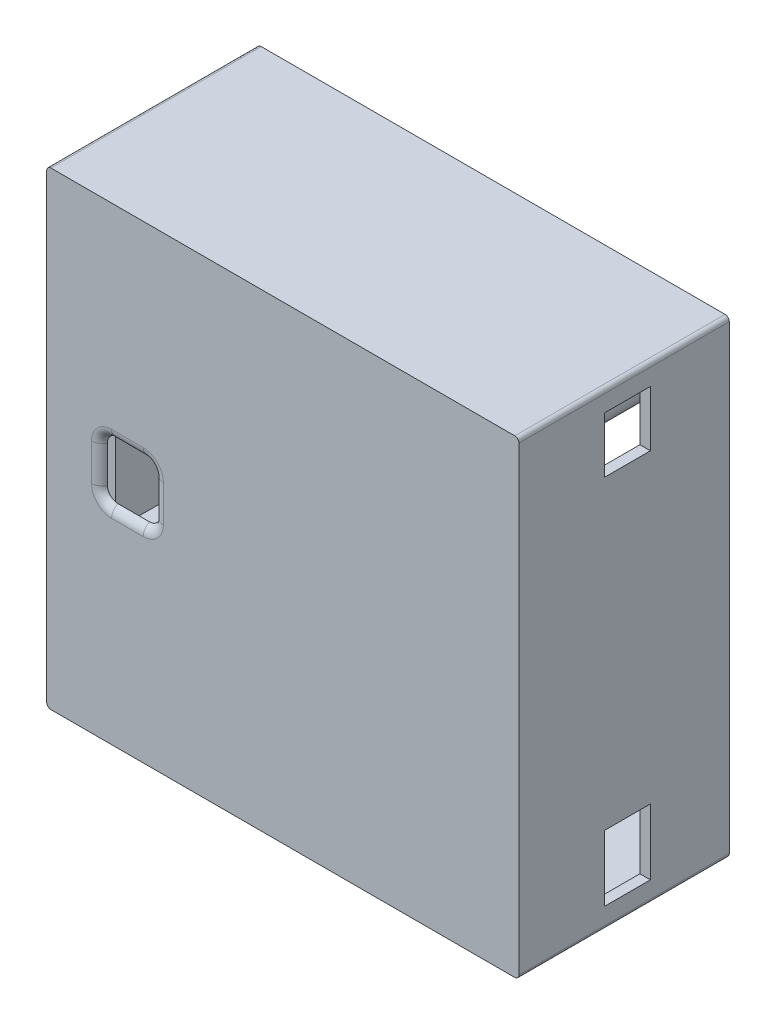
SolidWorks part; units mm, degrees
ref_plane "Front Plane" through (0, 0, 0) normal (0, 0, 1) x (1, 0, 0)
ref_plane "Top Plane" through (0, 0, 0) normal (0, 1, 0) x (1, 0, 0)
ref_plane "Right Plane" through (0, 0, 0) normal (1, 0, 0) x (0, 0, -1)
sketch "Sketch1" plane through (0, 0, 0) normal (0, 0, 1) x (1, 0, 0)
  line L0 (-44.9, -44.6) -> (-44.9, 44.6)
  line L1 (-39.9, -39.6) -> (39.9, -39.6)
  line L2 (-39.9, -39.6) -> (-39.9, 39.6)
  line L3 (-39.9, 39.6) -> (39.9, 39.6)
  line L4 (39.9, -39.6) -> (39.9, 39.6)
  line L5 (-39.9, -39.6) -> (39.9, 39.6) construction
  line L6 (-39.9, 39.6) -> (39.9, -39.6) construction
  line L7 (-44.9, 44.6) -> (44.9, 44.6)
  line L8 (44.9, -44.6) -> (44.9, 44.6)
  line L9 (-44.9, -44.6) -> (44.9, -44.6)
  point P0 (0, 0)
  dimension "D1" = 79.2
  dimension "D2" = 79.8
  dimension "D3" = 5
extrude "Boss-Extrude1" add sketch "Sketch1" along normal blind 40
sketch "Sketch2" plane through (0, 0, 40) normal (0, 0, 1) x (1, 0, 0)
  line L0 (39.9, -39.6) -> (39.9, 39.6) construction
  line L1 (39.9, 39.6) -> (-39.9, 39.6) construction
  line L2 (31.8973, 39.6) -> (39.9, 39.6)
  line L3 (39.9, 39.6) -> (39.9, 30.4655)
  line L4 (39.9, 0) -> (35.9467, 0)
  line L5 (39.9, -39.6) -> (39.9, -30.4655)
  line L6 (31.8973, -39.6) -> (39.9, -39.6)
  line L7 (0, 39.6) -> (0, 51.3482) construction
  line L8 (-31.8973, -39.6) -> (-39.9, -39.6)
  line L9 (-39.9, -39.6) -> (-39.9, -30.4655)
  line L10 (-39.9, 0) -> (-35.9467, 0)
  line L11 (-39.9, 39.6) -> (-39.9, 30.4655)
  line L12 (-31.8973, 39.6) -> (-39.9, 39.6)
  arc A0 (39.9, 30.4655) -> (31.8973, 39.6) centre (37.6432, 36.5611) cw
  arc A1 (39.9, -30.4655) -> (31.8973, -39.6) centre (37.6432, -36.5611) ccw
  arc A2 (-39.9, -30.4655) -> (-31.8973, -39.6) centre (-37.6432, -36.5611) cw
  arc A3 (-39.9, 30.4655) -> (-31.8973, 39.6) centre (-37.6432, 36.5611) ccw
  dimension "D1" = 6.5
extrude "Boss-Extrude2" add sketch "Sketch2" against normal blind 30.82 contours A3 M10 M7 | A0 M8 M7 | A2 M10 M9
sketch "Sketch3" plane through (0, 0, 40) normal (0, 0, 1) x (1, 0, 0)
  line L0 (-31.8973, -39.6) -> (39.9, -39.6) construction
  line L1 (30.704, -39.6) -> (20.704, -39.6)
  line L2 (30.704, -39.6) -> (30.704, -30.067)
  line L3 (30.704, -30.067) -> (20.704, -30.067)
  line L4 (20.704, -39.6) -> (20.704, -30.067)
  point P6 (30.704, -39.6)
  dimension "D1" = 10
extrude "Boss-Extrude3" add sketch "Sketch3" against normal blind 30.82 separate body
sketch "Sketch4" plane through (0, 0, 40) normal (0, 0, 1) x (1, 0, 0)
  line L0 (31.8973, 39.6) -> (-31.8973, 39.6) construction
  line L1 (39.9, -39.6) -> (-39.9, -39.6)
  line L2 (39.9, -39.6) -> (39.9, 39.6)
  line L3 (39.9, 39.6) -> (-39.9, 39.6)
  line L4 (-39.9, -39.6) -> (-39.9, 39.6)
  line L5 (-39.9, 30.4655) -> (-39.9, -30.4655) construction
  dimension "D1" = 0
  dimension "D2" = 0
extrude "Cut-Extrude1" cut sketch "Sketch4" against normal blind 25
sketch "Sketch6" plane through (0, 0, 9.18) normal (0, 0, -1) x (-1, 0, 0)
  line L0 (0, 39.6) -> (0, 35.6)
  line L1 (-39.9, 39.6) -> (39.9, 39.6) construction
  circle A0 centre (-36, 35.6) radius 7
  circle A1 centre (-36, 35.6) radius 2.25
  circle A3 centre (35.8, 35.4) radius 2.25
  circle A4 centre (35.5, -35.3) radius 2.25
  circle A5 centre (-26.2, -34.8) radius 2.25
  dimension "D1" = 14
  dimension "D2" = 4.5
  dimension "D3" = 4.5
  dimension "D4" = 4.5
  dimension "D5" = 4.5
extrude "Boss-Extrude4" add sketch "Sketch6" along normal blind 2.5 contours A1 | A3 | A4 | A5
sketch "Sketch7" plane through (0, 0, 15) normal (0, 0, 1) x (1, 0, 0)
  line L0 (-39.9, 0) -> (-37.6432, 0)
  line L1 (-39.9, 39.6) -> (-39.9, -39.6) construction
  arc A0 (-31.8973, -39.6) -> (-39.9, -30.4655) centre (-37.6432, -36.5611) ccw
  arc A1 (-31.8973, -39.6) -> (-39.9, -30.4655) centre (-39.5186, -38.2041) ccw
  arc A2 (-31.8973, 39.6) -> (-39.9, 30.4655) centre (-39.5186, 38.2041) cw
  arc A3 (-31.8973, 39.6) -> (-39.9, 30.4655) centre (-37.6432, 36.5611) cw
extrude "Cut-Extrude2" cut sketch "Sketch7" against normal blind 18 contours A3 A2 | A1 M2
sketch "Sketch8" plane through (0, 0, 6.68) normal (0, 0, -1) x (-1, 0, 0)
  circle A0 centre (-26.2, -34.8) radius 2.25
  circle A1 centre (-26.2, -34.8) radius 2.4
  circle A2 centre (-36, 35.6) radius 2.4
  circle A3 centre (35.8, 35.4) radius 2.4
  circle A4 centre (35.5, -35.3) radius 2.4
  dimension "D1" = 4.8
  dimension "D2" = 4.8
  dimension "D3" = 4.8
  dimension "D4" = 4.8
extrude "Boss-Extrude5" add sketch "Sketch8" against normal up to surface (8.32 mm away)
sketch "Sketch9" plane through (0, 0, 0) normal (0, 0, -1) x (-1, 0, 0)
  line L0 (-41.1, -40.8) -> (41.1, -40.8)
  line L1 (-39.9, -39.6) -> (39.9, -39.6)
  line L2 (-39.9, -39.6) -> (-39.9, 39.6)
  line L3 (-39.9, 39.6) -> (39.9, 39.6)
  line L4 (39.9, -39.6) -> (39.9, 39.6)
  line L5 (41.1, -40.8) -> (41.1, 40.8)
  line L6 (-41.1, 40.8) -> (41.1, 40.8)
  line L7 (-41.1, -40.8) -> (-41.1, 40.8)
  dimension "D1" = 1.2
extrude "Cut-Extrude3" cut sketch "Sketch9" against normal up to surface (9.18 mm away)
sketch "Sketch10" plane through (0, 0, 40) normal (0, 0, 1) x (1, 0, 0)
  line L0 (42.9, 42.6) -> (-42.9, 42.6)
  line L1 (39.9, 39.6) -> (-39.9, 39.6)
  line L2 (39.9, 39.6) -> (39.9, -39.6)
  line L3 (39.9, -39.6) -> (-39.9, -39.6)
  line L4 (-39.9, 39.6) -> (-39.9, -39.6)
  line L5 (-42.9, 42.6) -> (-42.9, -42.6)
  line L6 (42.9, -42.6) -> (-42.9, -42.6)
  line L7 (42.9, 42.6) -> (42.9, -42.6)
  dimension "D1" = 3
extrude "Cut-Extrude4" cut sketch "Sketch10" against normal up to surface (25 mm away)
sketch "Sketch11" plane through (42.9, 0, 0) normal (-1, 0, 0) x (0, 0, 1)
  line L0 (15, 42.6) -> (15, -42.6) construction
  line L1 (15, 40.63) -> (23.7, 40.63)
  line L2 (15, 40.63) -> (15, 30.03)
  line L3 (15, 30.03) -> (23.7, 30.03)
  line L4 (23.7, 40.63) -> (23.7, 30.03)
  line L5 (15, 42.6) -> (40, 42.6) construction
  line L6 (15, -42.6) -> (40, -42.6) construction
  line L7 (15, -40.63) -> (23.7, -40.63)
  line L8 (15, -40.63) -> (15, -28.13)
  line L9 (15, -28.13) -> (23.7, -28.13)
  line L10 (23.7, -40.63) -> (23.7, -28.13)
extrude "Cut-Extrude5" cut sketch "Sketch11" against normal blind 6
sketch "Sketch12" plane through (42.9, 0, 0) normal (-1, 0, 0) x (0, 0, 1)
  line L39 (15, 42.63) -> (15, 40.63)
  line L40 (15, 40.63) -> (23.7, 40.63)
  line L41 (23.7, 40.63) -> (23.7, 30.03)
  line L42 (15, 28.03) -> (25.7, 28.03)
  line L43 (25.7, 42.63) -> (15, 42.63)
  line L44 (25.7, 28.03) -> (25.7, 42.63)
  line L45 (15, 28.03) -> (25.7, 28.03)
  line L46 (25.7, 42.63) -> (15, 42.63)
  line L47 (25.7, 28.03) -> (25.7, 42.63)
  line L48 (23.7, 30.03) -> (15, 30.03)
  line L49 (15, 30.03) -> (15, 28.03)
  line L56 (15, -26.13) -> (15, -28.13)
  line L57 (15, -28.13) -> (23.7, -28.13)
  line L58 (23.7, -28.13) -> (23.7, -40.63)
  line L59 (15, -42.63) -> (25.7, -42.63)
  line L60 (25.7, -26.13) -> (15, -26.13)
  line L61 (25.7, -42.63) -> (25.7, -26.13)
  line L62 (15, -42.63) -> (25.7, -42.63)
  line L63 (25.7, -26.13) -> (15, -26.13)
  line L64 (25.7, -42.63) -> (25.7, -26.13)
  line L65 (23.7, -40.63) -> (15, -40.63)
  line L66 (15, -40.63) -> (15, -42.63)
  dimension "D1" = 2
  dimension "D2" = 2
extrude "Boss-Extrude6" add sketch "Sketch12" along normal blind 5
sketch "Sketch13" plane through (0, 0, 40) normal (0, 0, 1) x (1, 0, 0)
  line L17 (-44.9, -44.6) -> (44.9, -44.6)
  line L18 (44.9, -44.6) -> (44.9, 44.6)
  line L19 (44.9, 44.6) -> (-44.9, 44.6)
  line L20 (-44.9, 44.6) -> (-44.9, -44.6)
  line L21 (-44.9, -44.6) -> (44.9, -44.6)
  line L22 (44.9, -44.6) -> (44.9, 44.6)
  line L23 (44.9, 44.6) -> (-44.9, 44.6)
  line L24 (-44.9, 44.6) -> (-44.9, -44.6)
  line L35 (-42.9, -42.6) -> (42.9, -42.6)
  line L36 (42.9, -42.6) -> (42.9, 42.6)
  line L37 (42.9, 42.6) -> (-42.9, 42.6)
  line L38 (-42.9, 42.6) -> (-42.9, -42.6)
  line L39 (-42.9, -42.6) -> (42.9, -42.6)
  line L40 (42.9, -42.6) -> (42.9, 42.6)
  line L41 (42.9, 42.6) -> (-42.9, 42.6)
  line L42 (-42.9, 42.6) -> (-42.9, -42.6)
  dimension "D1" = 0
  dimension "D2" = 0
sketch "Sketch14" plane through (0, 0, 40) normal (0, 0, 1) x (1, 0, 0)
  line L1 (-44.9, 44.6) -> (44.9, 44.6)
  line L2 (-44.9, 44.6) -> (-44.9, -44.6)
  line L3 (-44.9, -44.6) -> (44.9, -44.6)
  line L4 (44.9, 44.6) -> (44.9, -44.6)
  line L5 (-42.9, 42.6) -> (42.9, 42.6) construction
  line L6 (-42.9, 42.6) -> (-42.9, -42.6) construction
  line L7 (-42.9, -42.6) -> (42.9, -42.6) construction
  line L8 (42.9, 42.6) -> (42.9, -42.6) construction
extrude "Boss-Extrude7" add sketch "Sketch14" against normal blind 1.2
sketch "Sketch15" plane through (0, 0, 38.8) normal (0, 0, -1) x (-1, 0, 0)
  circle A0 centre (-36, 35.6) radius 2.4
  circle A1 centre (35.8, 35.4) radius 2.4
  circle A2 centre (35.5, -35.3) radius 2.4
  circle A3 centre (-26.2, -34.8) radius 2.4
sketch "Sketch16" plane through (0, 0, 0) normal (0, 0, -1) x (-1, 0, 0)
  line L5 (-42.9, 42.6) -> (42.9, 42.6)
  line L6 (-42.9, 42.6) -> (-42.9, -42.6)
  line L7 (-42.9, -42.6) -> (42.9, -42.6)
  line L8 (42.9, 42.6) -> (42.9, -42.6)
extrude "Cut-Extrude7" cut sketch "Sketch16" against normal up to next
sketch "Sketch17" plane through (0, 0, 38.8) normal (0, 0, -1) x (-1, 0, 0)
  circle A0 centre (-36, 35.6) radius 2.4
  circle A1 centre (35.8, 35.4) radius 2.4
  circle A2 centre (35.5, -35.3) radius 2.4
  circle A3 centre (-26.2, -34.8) radius 2.4
  circle A4 centre (-36, 35.6) radius 3.9
  circle A5 centre (35.8, 35.4) radius 3.9
  circle A6 centre (35.5, -35.3) radius 3.9
  circle A7 centre (-26.2, -34.8) radius 3.9
  dimension "D1" = 1.5
extrude "Boss-Extrude8" add sketch "Sketch17" along normal blind 29.62 contours A4 | A5 | A6 | A7
sketch "Sketch18" plane through (0, 0, 9.18) normal (0, 0, -1) x (-1, 0, 0)
  circle A0 centre (-36, 35.6) radius 2
  circle A1 centre (35.8, 35.4) radius 2
  circle A2 centre (35.5, -35.3) radius 2
  circle A3 centre (-26.2, -34.8) radius 2
  dimension "D1" = 4
  dimension "D2" = 4
  dimension "D3" = 4
  dimension "D4" = 4
extrude "Boss-Extrude9" add sketch "Sketch18" along normal blind 2.5
sketch "Sketch19" plane through (0, 0, 38.8) normal (0, 0, -1) x (-1, 0, 0)
  line L0 (35.0326, -12) -> (35.0326, 12)
  line L1 (26.0326, 12) -> (35.0326, 12)
  line L2 (26.0326, -12) -> (26.0326, 12)
  line L3 (26.0326, -12) -> (35.0326, -12)
  line L4 (28.0326, -10) -> (28.0326, -12)
  line L5 (28.0326, -10) -> (33.0326, -10)
  line L6 (28.0326, -10) -> (28.0326, 10)
  line L7 (28.0326, 10) -> (33.0326, 10)
  line L8 (33.0326, -10) -> (33.0326, 10)
  line L9 (28.0326, -10) -> (33.0326, 10) construction
  line L10 (28.0326, 10) -> (33.0326, -10) construction
  line L11 (28.0326, -12) -> (28.0326, 12)
  point P0 (30.5326, 0)
  dimension "D1" = 5
extrude "Boss-Extrude10" add sketch "Sketch19" along normal blind 20 contours L11 L7 L8 L5 L4 L3 L0 L1
sketch "Sketch20" plane through (0, 0, 18.8) normal (0, 0, -1) x (-1, 0, 0)
  line L1 (28.0326, 12) -> (35.0326, 12)
  line L2 (28.0326, 12) -> (28.0326, -12)
  line L3 (28.0326, -12) -> (35.0326, -12)
  line L4 (35.0326, 12) -> (35.0326, -12)
extrude "Boss-Extrude11" add sketch "Sketch20" along normal blind 2
sketch "Sketch21" plane through (0, 0, 40) normal (0, 0, 1) x (1, 0, 0)
  line L0 (-32.5533, -5.5) -> (-26.5533, -5.5)
  line L1 (-34.5533, -3.5) -> (-34.5533, 3.5)
  line L2 (-32.5533, 5.5) -> (-26.5533, 5.5)
  line L3 (-24.5533, -3.5) -> (-24.5533, 3.5)
  line L4 (-34.5533, -5.5) -> (-24.5533, 5.5) construction
  line L5 (-34.5533, 5.5) -> (-24.5533, -5.5) construction
  arc A0 (-34.5533, 3.5) -> (-32.5533, 5.5) centre (-32.5533, 3.5) cw
  arc A1 (-34.5533, -3.5) -> (-32.5533, -5.5) centre (-32.5533, -3.5) ccw
  arc A2 (-26.5533, -5.5) -> (-24.5533, -3.5) centre (-26.5533, -3.5) ccw
  arc A3 (-26.5533, 5.5) -> (-24.5533, 3.5) centre (-26.5533, 3.5) cw
  point P0 (-29.5533, 0)
  dimension "D3" = 2
  dimension "D1" = 10
  dimension "D2" = 11
extrude "Cut-Extrude9" cut sketch "Sketch21" against normal blind 1.2
fillet "Fillet1" radius 2 8 edges at (-33.9675, 4.9142, 40) (-29.5533, 5.5, 40) (-25.1391, 4.9142, 40) (-24.5533, 0, 40) (-25.1391, -4.9142, 40) (-29.5533, -5.5, 40) (-33.9675, -4.9142, 40) (-34.5533, 0, 40)
fillet "Fillet3" radius 0.8 4 edges at (44.9, 44.6, 20) (-44.9, 44.6, 20) (-44.9, -44.6, 20) (44.9, -44.6, 20)
equation "\"D6@Sketch11\"=\"D3@Sketch11\""
